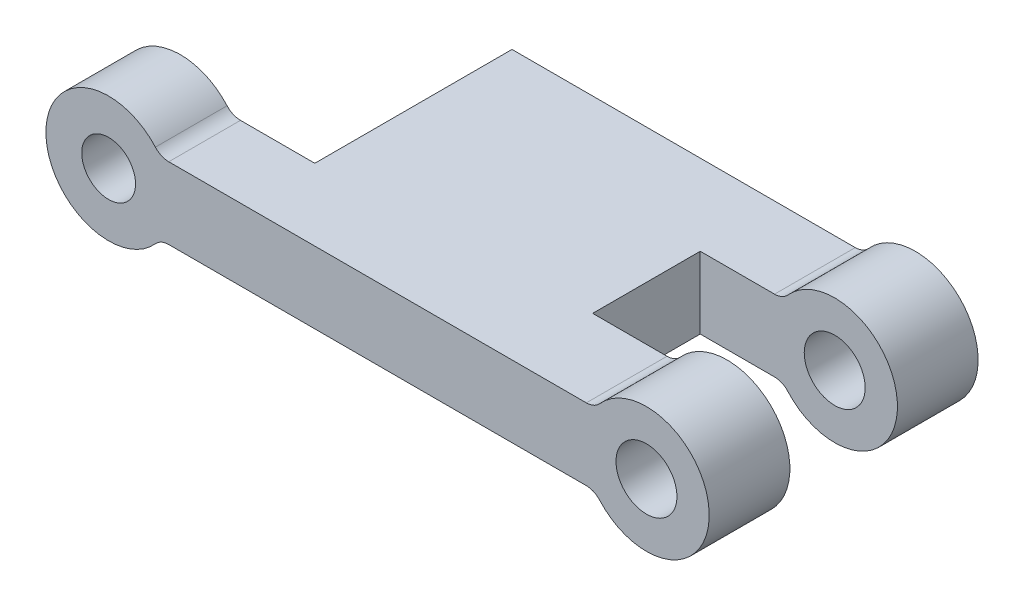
SolidWorks part; units mm, degrees
ref_plane "Front Plane" through (0, 0, 0) normal (0, 0, 1) x (1, 0, 0)
ref_plane "Top Plane" through (0, 0, 0) normal (0, 1, 0) x (1, 0, 0)
ref_plane "Right Plane" through (0, 0, 0) normal (1, 0, 0) x (0, 0, -1)
sketch "Sketch1" plane through (0, 0, 0) normal (0, 0, 1) x (1, 0, 0)
  line L0 (3.3541, 2) -> (26.6459, 2)
  line L1 (3.3541, -2) -> (26.6459, -2)
  line L3 (64.5441, -2) -> (85.8681, -2) construction
  line L4 (64.5441, 2) -> (85.8681, 2) construction
  line L5 (15, 2) -> (15, -2) construction
  arc A0 (2.6087, 2.3333) -> (2.6087, -2.3333) centre (0, 0) ccw
  arc A2 (3.3541, -2) -> (2.6087, -2.3333) centre (3.3541, -3) ccw
  arc A3 (3.3541, 2) -> (2.6087, 2.3333) centre (3.3541, 3) cw
  arc A4 (27.3913, -2.3333) -> (27.3913, 2.3333) centre (30, 0) ccw
  circle A6 centre (0, 0) radius 1.5
  arc A7 (26.6459, -2) -> (27.3913, -2.3333) centre (26.6459, -3) cw
  arc A8 (26.6459, 2) -> (27.3913, 2.3333) centre (26.6459, 3) ccw
  point P7 (15, 0)
  dimension "D1" = 7
  dimension "D3" = 1
  dimension "D4" = 3
  dimension "D5" = 1
  dimension "D7" = 30
  dimension "D2" = 4
extrude "Boss-Extrude1" add sketch "Sketch1" along normal blind 4 contours L1 L0 A3 A0 A2
sketch "Sketch2" plane through (0, 0, 0) normal (0, 0, -1) x (-1, 0, 0)
  line L0 (-7.5, -2) -> (-7.5, 2)
  line L1 (-7.5, -2) -> (-22.5, -2)
  line L2 (-7.5, 2) -> (-22.5, 2)
  line L3 (-22.5, -2) -> (-22.5, 2)
  line L4 (-3.3541, -2) -> (-26.6459, -2) construction
  line L5 (-26.6459, 2) -> (-3.3541, 2) construction
  line L6 (-22.5, -2) -> (-7.5, 2) construction
  point P8 (-15, 0)
  point P9 (-15, -2)
  dimension "D1" = 15
extrude "Boss-Extrude2" add sketch "Sketch2" along normal blind 11
sketch "Sketch3" plane through (0, 0, -11) normal (0, 0, -1) x (-1, 0, 0)
  line L0 (-22.5, 2) -> (-22.5, -2) construction
  line L1 (-26.6459, 2) -> (-22.5, 2) construction
  line L2 (-22.5, -2) -> (-26.6459, -2) construction
  line L3 (-22.5, 2) -> (-22.5, -2)
  line L4 (-26.6459, 2) -> (-22.5, 2)
  line L5 (-22.5, -2) -> (-26.6459, -2)
  arc A0 (-27.3913, 2.3333) -> (-26.6459, 2) centre (-26.6459, 3) ccw construction
  arc A1 (-27.3913, 2.3333) -> (-27.3913, -2.3333) centre (-30, 0) ccw construction
  arc A2 (-26.6459, -2) -> (-27.3913, -2.3333) centre (-26.6459, -3) ccw construction
  arc A3 (-27.3913, 2.3333) -> (-26.6459, 2) centre (-26.6459, 3) ccw
  arc A4 (-27.3913, 2.3333) -> (-27.3913, -2.3333) centre (-30, 0) ccw
  arc A5 (-26.6459, -2) -> (-27.3913, -2.3333) centre (-26.6459, -3) ccw
extrude "Boss-Extrude3" add sketch "Sketch3" against normal blind 4.5
sketch "Sketch4" plane through (0, 0, 0) normal (0, 0, -1) x (-1, 0, 0)
  line L1 (-22.5, 2) -> (-22.5, -2) construction
  line L2 (-26.6459, 2) -> (-22.5, 2) construction
  line L3 (-22.5, -2) -> (-26.6459, -2) construction
  line L4 (-22.5, 2) -> (-22.5, -2)
  line L5 (-26.6459, 2) -> (-22.5, 2)
  line L6 (-22.5, -2) -> (-26.6459, -2)
  arc A0 (-27.3913, 2.3333) -> (-26.6459, 2) centre (-26.6459, 3) ccw construction
  arc A1 (-27.3913, 2.3333) -> (-27.3913, -2.3333) centre (-30, 0) ccw construction
  arc A2 (-26.6459, -2) -> (-27.3913, -2.3333) centre (-26.6459, -3) ccw construction
  arc A3 (-27.3913, 2.3333) -> (-26.6459, 2) centre (-26.6459, 3) ccw
  arc A4 (-27.3913, 2.3333) -> (-27.3913, -2.3333) centre (-30, 0) ccw
  arc A5 (-26.6459, -2) -> (-27.3913, -2.3333) centre (-26.6459, -3) ccw
extrude "Boss-Extrude4" add sketch "Sketch4" along normal blind 0.5
hole_wizard "M3 Clearance Hole1" positions "Sketch5" profile "Sketch6" hole size "M3" standard "ISO"
sketch "Sketch5" plane through (0, 0, 4) normal (0, 0, 1) x (1, 0, 0)
  point P0 (30, 0)
sketch "Sketch6" plane through (30, 0, 4) normal (1, 0, 0) x (0, -1, 0)
  line L0 (0, 0) -> (0, 15)
  line L1 (0, 15) -> (1.7, 15)
  line L2 (1.7, 15) -> (1.7, 0)
  line L5 (1.7, 0) -> (0, 0)
  line L11 (0, -6.35) -> (0, 107.95) construction
  dimension "Thru Hole Dia." = 3.4
  dimension "Thru Hole Depth" = 15
